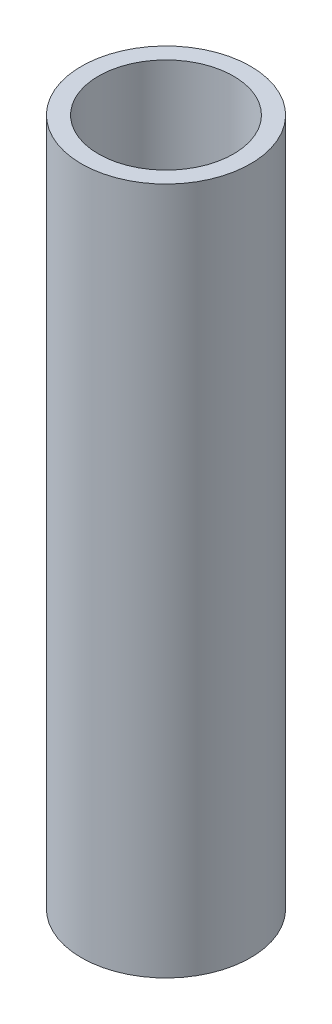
SolidWorks part; units mm, degrees
ref_plane "Front Plane" through (0, 0, 0) normal (0, 0, 1) x (1, 0, 0)
ref_plane "Top Plane" through (0, 0, 0) normal (0, 1, 0) x (1, 0, 0)
ref_plane "Right Plane" through (0, 0, 0) normal (1, 0, 0) x (0, 0, -1)
sketch "Sketch1" plane through (0, 0, 0) normal (0, 1, 0) x (1, 0, 0)
  circle A0 centre (0, 0) radius 12.8098
extrude "Extrude1" add sketch "Sketch1" along normal blind 2.54
sketch "Sketch2" plane through (0, 2.54, 0) normal (0, 1, 0) x (1, 0, 0)
  circle A0 centre (0, 0) radius 10.2273
  circle A1 centre (0, 0) radius 12.8098
extrude "Extrude2" add sketch "Sketch2" along normal blind 101.6
